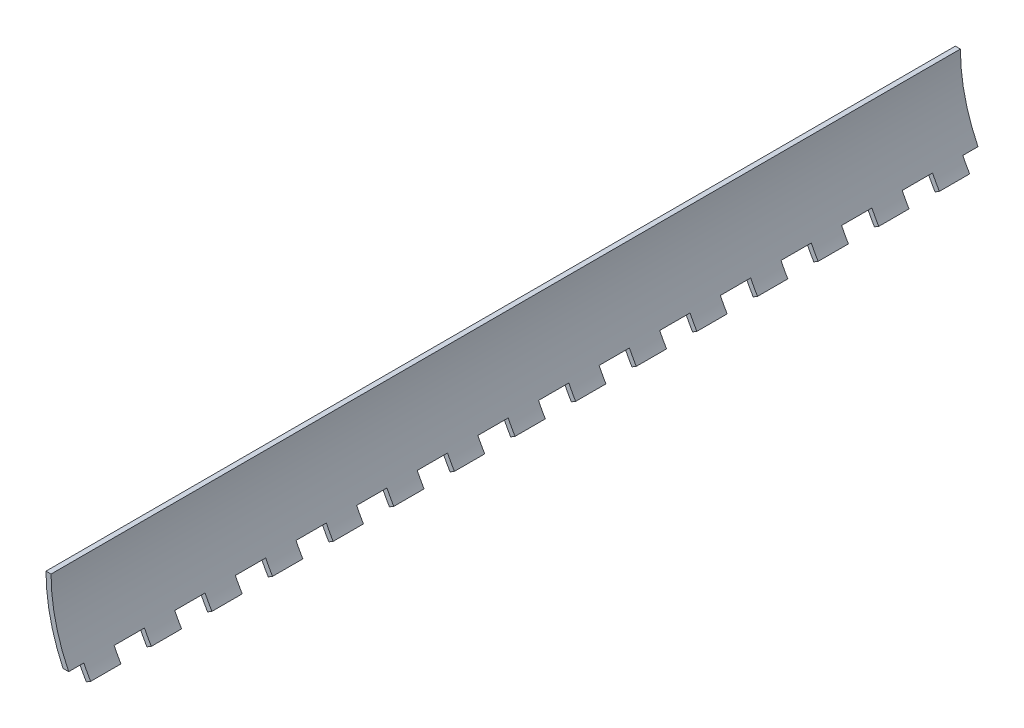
SolidWorks part; units mm, degrees
ref_plane "Face" through (0, 0, 0) normal (0, 0, 1) x (1, 0, 0)
ref_plane "Dessus" through (0, 0, 0) normal (0, 1, 0) x (1, 0, 0)
ref_plane "Droite" through (0, 0, 0) normal (1, 0, 0) x (0, 0, -1)
sketch "Esquisse1" plane through (0, 0, 0) normal (0, 0, 1) x (1, 0, 0)
  arc A0 (0, 0) -> (4.9833, -18) centre (35, 0) ccw
  dimension "D1" = 35
  dimension "D2" = 18
extrude "Extru.-Mince1" add sketch "Esquisse1" along normal mid plane 180 thin
sketch "Esquisse2" plane through (0, 0, 0) normal (1, 0, 0) x (0, 0, -1)
  line L0 (-90, -18) -> (90, -18) construction
  line L2 (3, -18) -> (9, -18)
  line L3 (3, -18) -> (3, -15)
  line L4 (3, -15) -> (9, -15)
  line L5 (9, -18) -> (9, -15)
  dimension "D1" = 6
  dimension "D2" = 3
  dimension "D3" = 3
extrude "Enlèv. mat.-Extru.2" cut sketch "Esquisse2" along normal through all
pattern_linear "Répétition linéaire1" count 8 spacing 12
mirror "Symétrie1" about plane through (0, 0, 0) normal (0, 0, 1)
